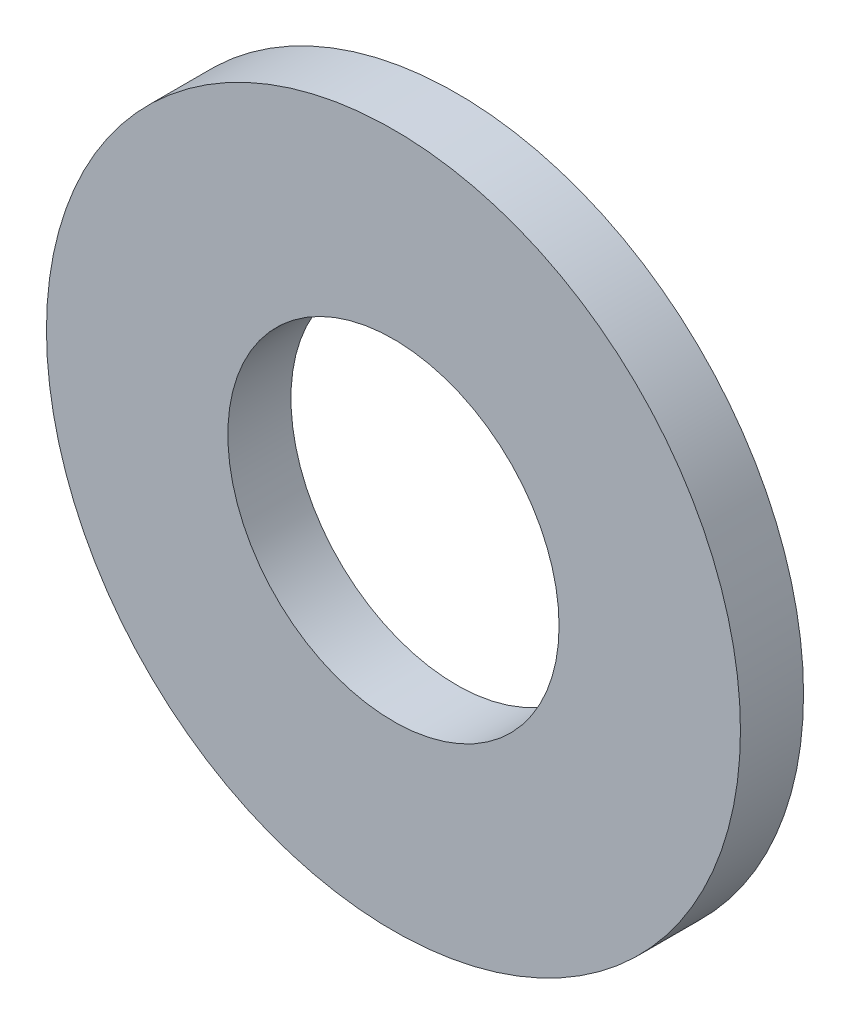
SolidWorks part; units mm, degrees
ref_plane "Plan de face" through (0, 0, 0) normal (0, 0, 1) x (1, 0, 0)
ref_plane "Plan de dessus" through (0, 0, 0) normal (0, 1, 0) x (1, 0, 0)
ref_plane "Plan de droite" through (0, 0, 0) normal (1, 0, 0) x (0, 0, -1)
sketch "Esquisse1" plane through (0, 0, 0) normal (0, 0, 1) x (1, 0, 0)
  circle A0 centre (0, 0) radius 11
  circle A1 centre (0, 0) radius 5.25
  dimension "D1" = 22
  dimension "D2" = 10.5
extrude "Extrusion1" add sketch "Esquisse1" along normal blind 2
